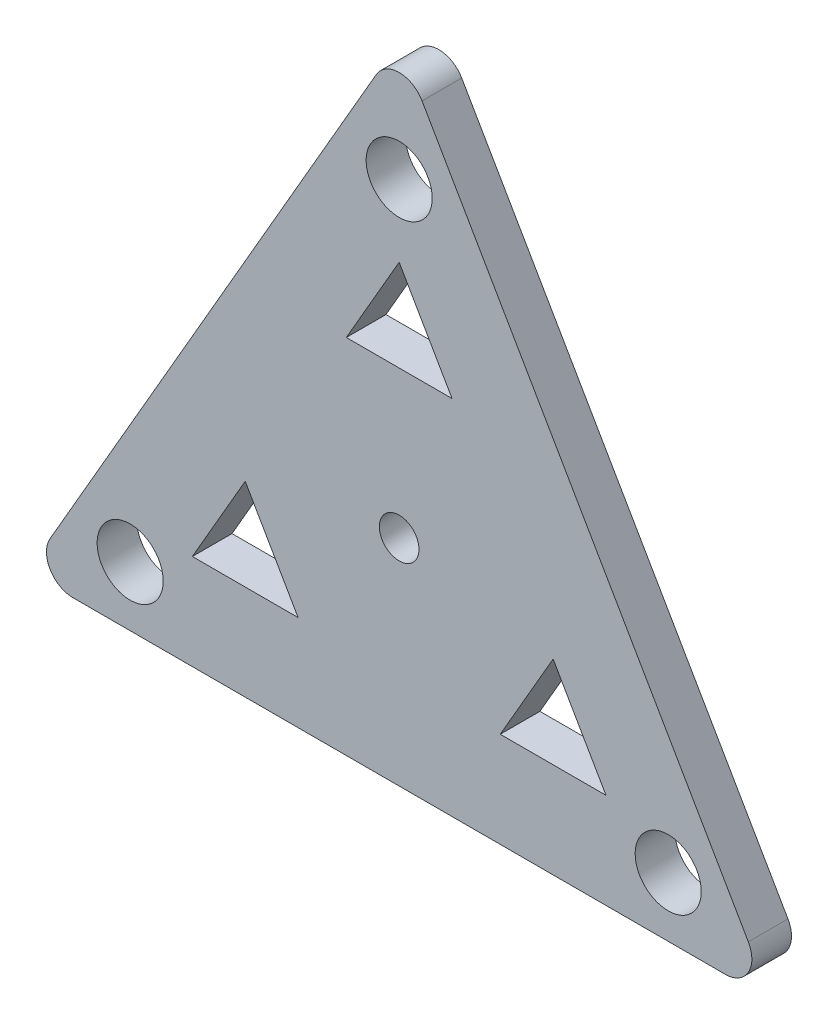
SolidWorks part; units mm, degrees
ref_plane "前视基准面" through (0, 0, 0) normal (0, 0, 1) x (1, 0, 0)
ref_plane "上视基准面" through (0, 0, 0) normal (0, 1, 0) x (1, 0, 0)
ref_plane "右视基准面" through (0, 0, 0) normal (1, 0, 0) x (0, 0, -1)
other "Configuration Table"
sketch "草图1" plane through (0, 0, 0) normal (0, 0, 1) x (1, 0, 0)
  line L0 (0, 32.5) -> (-28.1458, -16.25)
  line L1 (-28.1458, -16.25) -> (28.1458, -16.25)
  line L2 (28.1458, -16.25) -> (0, 32.5)
  dimension "D2" = 60
  dimension "D3" = 60
extrude "凸台-拉伸1" add sketch "草图1" along normal blind 3
fillet "圆角1" radius 2 3 edges at (28.1458, -16.25, 1.5) (-28.1458, -16.25, 1.5) (0, 32.5, 1.5)
sketch "草图2" plane through (0, 0, 3) normal (0, 0, 1) x (1, 0, 0)
  line L0 (26.4138, -15.25) -> (-21.9253, 12.6586) construction
  line L1 (-26.4138, -15.25) -> (16.0487, 9.2657) construction
  circle A0 centre (0, 23.5) radius 2.5
  arc A1 (24.6817, -16.25) -> (26.4138, -13.25) centre (24.6817, -14.25) ccw construction
  arc A2 (-26.4138, -13.25) -> (-24.6817, -16.25) centre (-24.6817, -14.25) ccw construction
  circle A3 centre (-20.3516, -11.75) radius 2.5
  circle A4 centre (20.3516, -11.75) radius 2.5
  dimension "D1" = 5
  dimension "D2" = 23.5
extrude "切除-拉伸1" cut sketch "草图2" against normal blind 3
sketch "草图3" plane through (0, 0, 3) normal (0, 0, 1) x (1, 0, 0)
  line L3 (0, 18.0672) -> (-4, 11.139)
  line L4 (-4, 11.139) -> (4, 11.139)
  line L5 (4, 11.139) -> (0, 18.0672)
  line L6 (-26.4138, -15.25) -> (25.8717, 14.9371) construction
  line L7 (26.4138, -15.25) -> (-19.9837, 11.5376) construction
  line L8 (26.4138, -13.25) -> (1.7321, 29.5) construction
  line L9 (-11.6467, -2.1054) -> (-7.6467, -9.0336)
  line L10 (-15.6467, -9.0336) -> (-11.6467, -2.1054)
  line L11 (-7.6467, -9.0336) -> (-15.6467, -9.0336)
  line L12 (7.6467, -9.0336) -> (11.6467, -2.1054)
  line L13 (15.6467, -9.0336) -> (7.6467, -9.0336)
  line L14 (11.6467, -2.1054) -> (15.6467, -9.0336)
  arc A0 (-26.4138, -13.25) -> (-24.6817, -16.25) centre (-24.6817, -14.25) ccw construction
  arc A1 (24.6817, -16.25) -> (26.4138, -13.25) centre (24.6817, -14.25) ccw construction
  dimension "D1" = 60
  dimension "D2" = 60
  dimension "D3" = 8
  dimension "D4" = 4
extrude "切除-拉伸3" cut sketch "草图3" against normal blind 3
sketch "草图4" plane through (0, 0, 3) normal (0, 0, 1) x (1, 0, 0)
  circle A0 centre (0, 0) radius 1.5
  dimension "D1" = 3
extrude "切除-拉伸4" cut sketch "草图4" against normal blind 10
